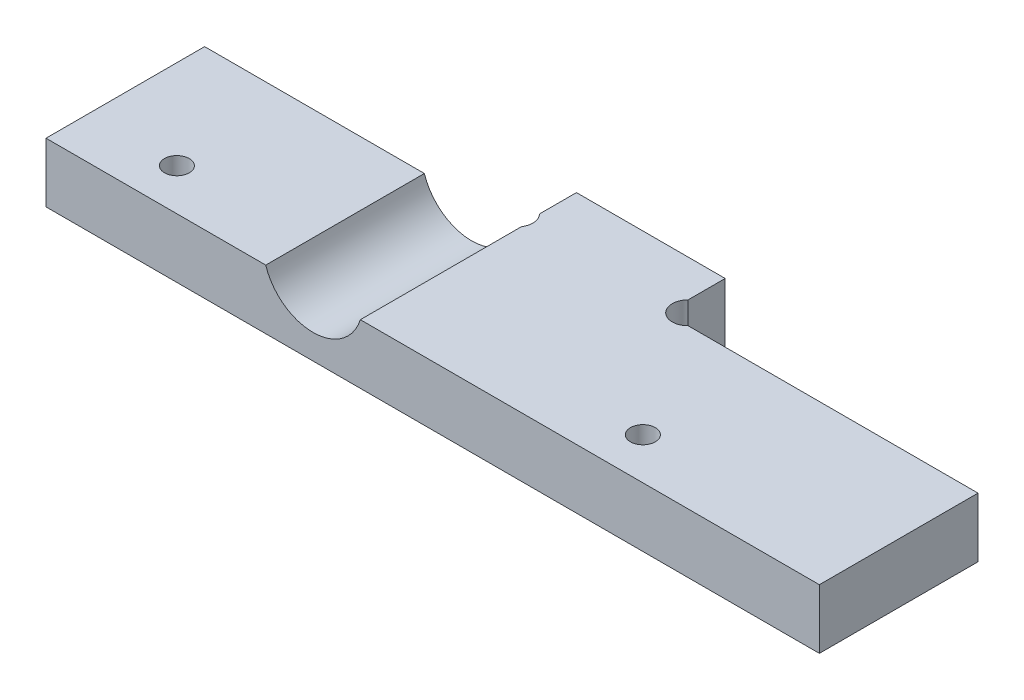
SolidWorks part; units mm, degrees
ref_plane "Plan de face" through (0, 0, 0) normal (0, 0, 1) x (1, 0, 0)
ref_plane "Plan de dessus" through (0, 0, 0) normal (0, 1, 0) x (1, 0, 0)
ref_plane "Plan de droite" through (0, 0, 0) normal (1, 0, 0) x (0, 0, -1)
sketch "Esquisse1" plane through (0, 0, 0) normal (0, 1, 0) x (1, 0, 0)
  line L0 (116.2108, 0) -> (-6.9054, 0) construction
  line L1 (116.2108, 16) -> (-6.9054, 16) construction
  line L2 (0, -21.5885) -> (0, 28.1805) construction
  line L3 (78, -21.5885) -> (78, 28.1805) construction
  line L4 (-6.9054, 22) -> (116.2108, 22) construction
  line L5 (39, 7.3044) -> (39, 24.3706) construction
  line L6 (31.5, 21.4494) -> (31.5, 7.3044) construction
  line L7 (31.5, 16) -> (22.1965, 25.3035) construction
  line L8 (34.5336, 19) -> (84.3639, 19) construction
  line L9 (-4.6394, 4.2) -> (80.6919, 4.2) construction
  line L10 (56, -21.5885) -> (56, 7.9194) construction
  line L11 (9, -21.5885) -> (9, 7.9194) construction
  line L12 (31.5, 18.2627) -> (31.5, 22)
  line L13 (31.5, 22) -> (46.5, 22)
  line L14 (46.5, 22) -> (46.5, 18.2627)
  line L15 (48.7627, 16) -> (78, 16)
  line L16 (78, 16) -> (78, 0)
  line L17 (78, 0) -> (0, 0)
  line L18 (0, 0) -> (0, 16)
  line L19 (0, 16) -> (29.2373, 16)
  circle A0 centre (56, 4.2) radius 1.25
  circle A1 centre (9, 4.2) radius 1.25
  arc A2 (29.2373, 16) -> (31.5, 18.2627) centre (30.3686, 17.1314) ccw
  arc A3 (48.7627, 16) -> (46.5, 18.2627) centre (47.6314, 17.1314) cw
  dimension "D1" = 78
  dimension "D2" = 39
  dimension "D3" = 6
  dimension "D4" = 16
  dimension "D5" = 7.5
  dimension "D6" = 45
  dimension "D7" = 3
  dimension "D8" = 11.8
  dimension "D9" = 22
  dimension "D10" = 9
extrude "Boss.-Extru.1" add sketch "Esquisse1" along normal blind 6
sketch "Esquisse2" plane through (0, 0, 0) normal (0, 0, 1) x (1, 0, 0)
  line L1 (31.4983, 9.8774) -> (28.5494, 9.9578) construction
  line L3 (0, -2.9082) -> (0, 13.676) construction
  line L4 (-6.2881, 0) -> (38.5915, 0) construction
  line L5 (0, 0) -> (78, 0) construction
  line L6 (-6.2881, 7.5) -> (36.4006, 7.5) construction
  line L7 (26.9338, -12.7339) -> (26.9338, 13.676) construction
  circle A0 centre (118.6952, 7.5) radius 5
  circle A1 centre (26.9338, 7.5) radius 5
  dimension "D1" = 7.5
  dimension "D2" = 26.9338
extrude "Enlèv. mat.-Extru.1" cut sketch "Esquisse2" against normal blind 16.5
